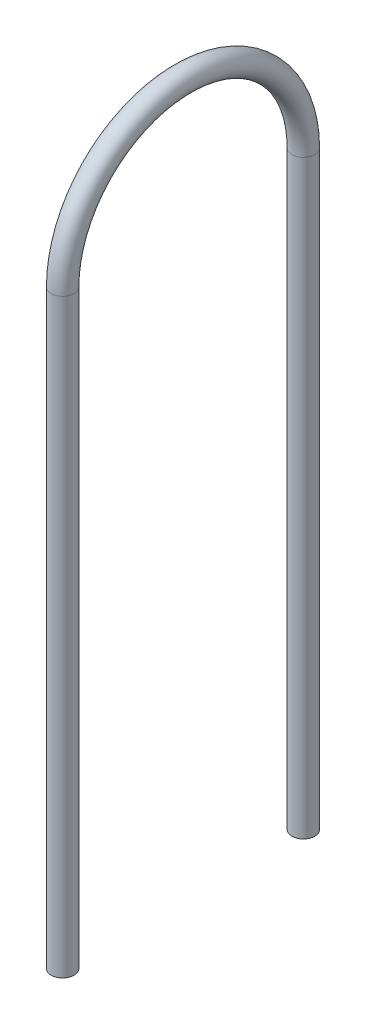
SolidWorks part; units mm, degrees
ref_plane "Front Plane" through (0, 0, 0) normal (0, 0, 1) x (1, 0, 0)
ref_plane "Top Plane" through (0, 0, 0) normal (0, 1, 0) x (1, 0, 0)
ref_plane "Right Plane" through (0, 0, 0) normal (1, 0, 0) x (0, 0, -1)
sketch "Sketch1" plane through (0, 0, 0) normal (1, 0, 0) x (0, 0, -1)
  line L0 (-21, 0) -> (-21, 103)
  line L1 (21, 0) -> (21, 103)
  line L3 (0, 103) -> (0, 0) construction
  arc A0 (21, 103) -> (-21, 103) centre (0, 103) ccw
  dimension "D6" = 42
  dimension "D8" = 103
sketch "Sketch2" plane through (0, 0, 0) normal (0, 1, 0) x (1, 0, 0)
  line L0 (0, -21) -> (0, 21) construction
  circle A0 centre (0, -21) radius 2
  dimension "D1" = 4
sweep "Sweep1" add profiles "Sketch2" path "Sketch1"
